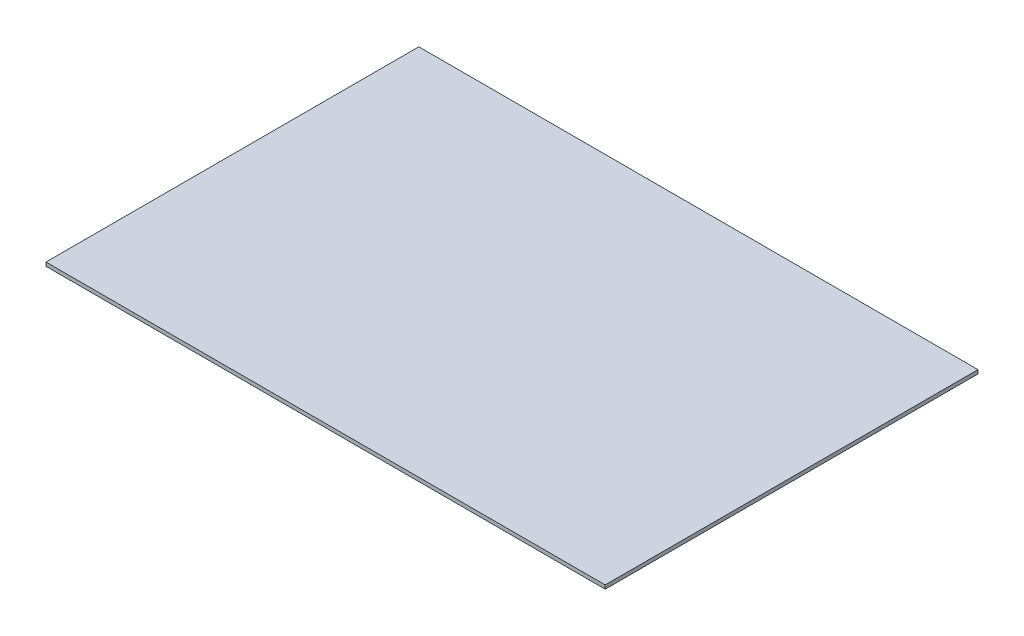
SolidWorks part; units mm, degrees
ref_plane "Front Plane" through (0, 0, 0) normal (0, 0, 1) x (1, 0, 0)
ref_plane "Top Plane" through (0, 0, 0) normal (0, 1, 0) x (1, 0, 0)
ref_plane "Right Plane" through (0, 0, 0) normal (1, 0, 0) x (0, 0, -1)
sketch "Sketch1" plane through (0, 0, 0) normal (0, 1, 0) x (1, 0, 0)
  line L1 (-750, -500) -> (750, -500)
  line L2 (-750, -500) -> (-750, 500)
  line L3 (-750, 500) -> (750, 500)
  line L4 (750, -500) -> (750, 500)
  line L5 (-750, -500) -> (750, 500) construction
  line L6 (-750, 500) -> (750, -500) construction
  point P0 (0, 0)
  dimension "D1" = 1000
  dimension "D2" = 1500
extrude "Boss-Extrude1" add sketch "Sketch1" along normal blind 10
